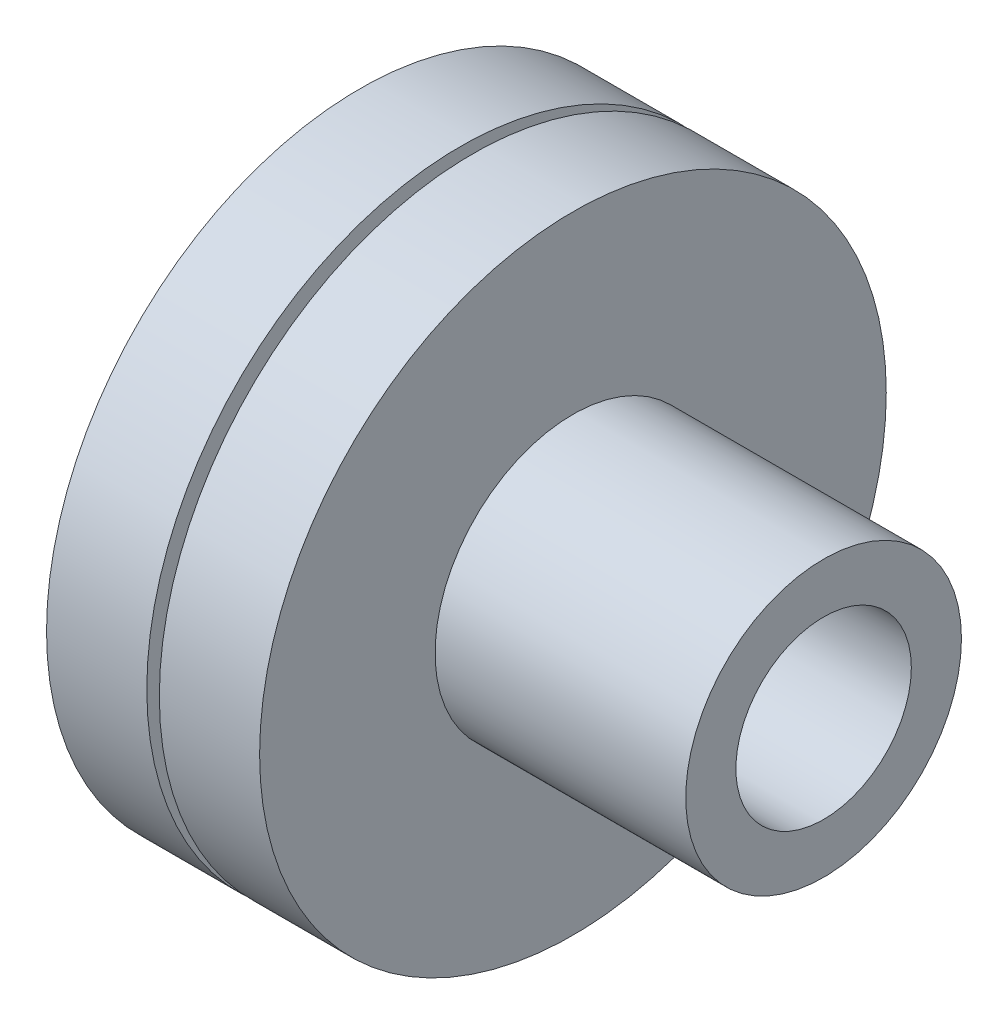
SolidWorks part; units mm, degrees
ref_plane "Front Plane" through (0, 0, 0) normal (0, 0, 1) x (1, 0, 0)
ref_plane "Top Plane" through (0, 0, 0) normal (0, 1, 0) x (1, 0, 0)
ref_plane "Right Plane" through (0, 0, 0) normal (1, 0, 0) x (0, 0, -1)
sketch "Sketch1" plane through (0, 0, 0) normal (0, 0, 1) x (1, 0, 0)
  line L0 (80, 125) -> (40, 125)
  line L1 (40, 125) -> (40, 55)
  line L2 (40, 55) -> (0, 55)
  line L3 (0, 55) -> (0, 35)
  line L4 (0, 35) -> (80, 35)
  line L5 (80, 35) -> (80, 125)
  line L6 (0, 0) -> (-64.8858, 0) construction
  line L7 (85, 35) -> (85, 125)
  line L8 (85, 125) -> (125, 125)
  line L9 (125, 125) -> (125, 55)
  line L10 (125, 55) -> (225, 55)
  line L11 (225, 55) -> (225, 35)
  line L12 (225, 35) -> (85, 35)
  dimension "D1" = 80
  dimension "D2" = 40
  dimension "D3" = 125
  dimension "D4" = 55
  dimension "D5" = 35
  dimension "D6" = 5
  dimension "D7" = 100
revolve "Revolve1" add sketch "Sketch1" angle 360 about L6
